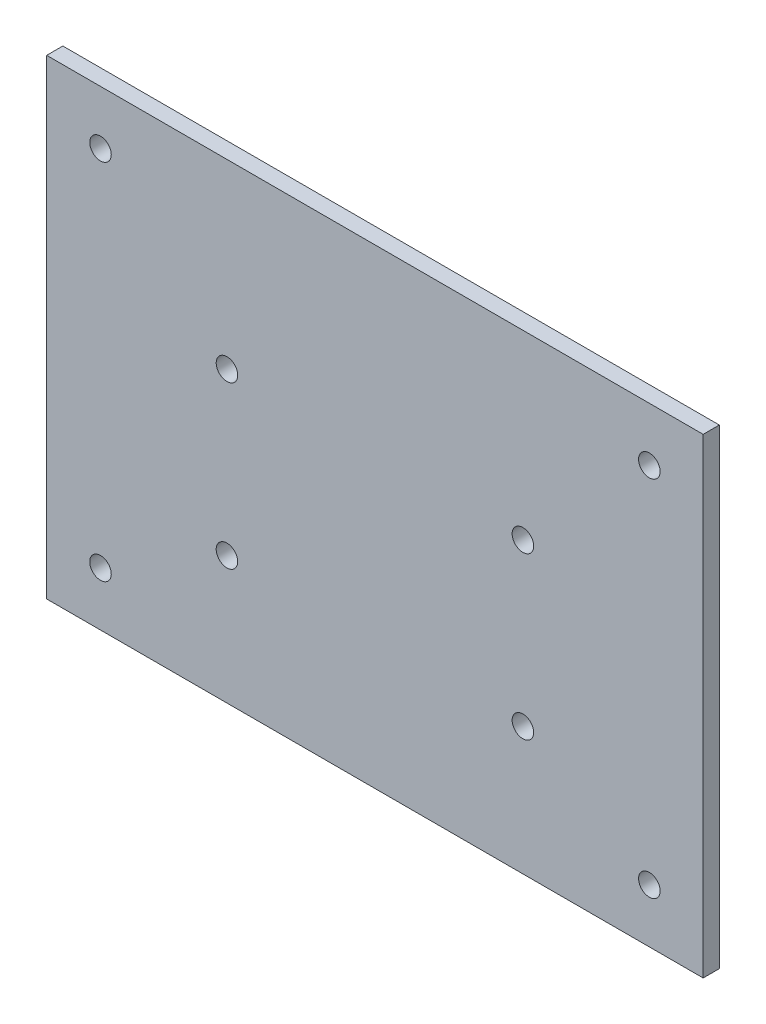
SolidWorks part; units mm, degrees
ref_plane "前视基准面" through (0, 0, 0) normal (0, 0, 1) x (1, 0, 0)
ref_plane "上视基准面" through (0, 0, 0) normal (0, 1, 0) x (1, 0, 0)
ref_plane "右视基准面" through (0, 0, 0) normal (1, 0, 0) x (0, 0, -1)
sketch "草图1" plane through (0, 0, 0) normal (0, 0, 1) x (1, 0, 0)
  line L1 (-61, 43.75) -> (61, 43.75)
  line L2 (-61, 43.75) -> (-61, -43.75)
  line L3 (-61, -43.75) -> (61, -43.75)
  line L4 (61, 43.75) -> (61, -43.75)
  line L5 (-61, 43.75) -> (61, -43.75) construction
  line L6 (-61, -43.75) -> (61, 43.75) construction
  point P0 (0, 0)
  dimension "D1" = 87.5
  dimension "D2" = 122
extrude "凸台-拉伸1" add sketch "草图1" along normal blind 3
hole_wizard "Ø4.0 (4) 直径孔1" positions "草图3" profile "草图4" hole size "Ø4.0" standard "GB"
sketch "草图3" plane through (0, 0, 3) normal (0, 0, 1) x (1, 0, 0)
  point P0 (-27.5, 10)
  point P2 (-27.5, -20)
  point P4 (27.5, 10)
  point P6 (27.5, -20)
  dimension "D1" = 30
  dimension "D2" = 30
  dimension "D3" = 10
  dimension "D4" = 10
  dimension "D5" = 27.5
  dimension "D6" = 27.5
  dimension "D7" = 27.5
  dimension "D8" = 27.5
sketch "草图4" plane through (-27.5, 10, 3) normal (1, 0, 0) x (0, -1, 0)
  line L0 (0, 0) -> (0, 3)
  line L1 (0, 3) -> (2, 3)
  line L2 (2, 3) -> (2, 0)
  line L5 (2, 0) -> (0, 0)
  line L11 (0, -6.35) -> (0, 107.95) construction
  dimension "通孔孔直径" = 4
  dimension "通孔孔深度" = 3
hole_wizard "Ø4.0 (4) 直径孔2" positions "草图5" profile "草图6" hole size "Ø4.0" standard "GB"
sketch "草图5" plane through (0, 0, 3) normal (0, 0, 1) x (1, 0, 0)
  line L0 (61, 43.75) -> (-61, 43.75) construction
  line L1 (-61, 43.75) -> (-61, -43.75) construction
  line L2 (61, -43.75) -> (61, 43.75) construction
  line L3 (-61, -43.75) -> (61, -43.75) construction
  point P0 (-51, 33.75)
  point P2 (-51, -33.75)
  point P4 (51, 33.75)
  point P6 (51, -33.75)
  dimension "D1" = 10
  dimension "D2" = 10
  dimension "D3" = 10
  dimension "D4" = 10
  dimension "D5" = 10
  dimension "D6" = 10
  dimension "D7" = 10
  dimension "D8" = 10
sketch "草图6" plane through (-51, 33.75, 3) normal (1, 0, 0) x (0, -1, 0)
  line L0 (0, 0) -> (0, 3)
  line L1 (0, 3) -> (2, 3)
  line L2 (2, 3) -> (2, 0)
  line L5 (2, 0) -> (0, 0)
  line L11 (0, -6.35) -> (0, 107.95) construction
  dimension "通孔孔直径" = 4
  dimension "通孔孔深度" = 3
sketch "草图7" plane through (0, 0, 3) normal (0, 0, 1) x (1, 0, 0)
  line L0 (-51, 35.75) -> (-51, 31.75) construction
  line L1 (-49, 35.75) -> (-49, 31.75)
  line L2 (-53, 35.75) -> (-53, 31.75)
  line L3 (-51, -31.75) -> (-51, -35.75) construction
  line L4 (-49, -31.75) -> (-49, -35.75)
  line L5 (-53, -31.75) -> (-53, -35.75)
  line L6 (-27.5, 12) -> (-27.5, 8) construction
  line L7 (-25.5, 12) -> (-25.5, 8)
  line L8 (-29.5, 12) -> (-29.5, 8)
  line L9 (-27.5, -18) -> (-27.5, -22) construction
  line L10 (-25.5, -18) -> (-25.5, -22)
  line L11 (-29.5, -18) -> (-29.5, -22)
  line L12 (27.5, 12) -> (27.5, 8) construction
  line L13 (29.5, 12) -> (29.5, 8)
  line L14 (25.5, 12) -> (25.5, 8)
  line L15 (27.5, -18) -> (27.5, -22) construction
  line L16 (29.5, -18) -> (29.5, -22)
  line L17 (25.5, -18) -> (25.5, -22)
  line L18 (51, -31.75) -> (51, -35.75) construction
  line L19 (53, -31.75) -> (53, -35.75)
  line L20 (49, -31.75) -> (49, -35.75)
  line L21 (51, 35.75) -> (51, 31.75) construction
  line L22 (53, 35.75) -> (53, 31.75)
  line L23 (49, 35.75) -> (49, 31.75)
  circle A0 centre (-51, 33.75) radius 2 construction
  arc A1 (-49, 35.75) -> (-53, 35.75) centre (-51, 35.75) ccw
  arc A2 (-53, 31.75) -> (-49, 31.75) centre (-51, 31.75) ccw
  circle A3 centre (-51, -33.75) radius 2 construction
  arc A4 (-49, -31.75) -> (-53, -31.75) centre (-51, -31.75) ccw
  arc A5 (-53, -35.75) -> (-49, -35.75) centre (-51, -35.75) ccw
  circle A6 centre (-27.5, 10) radius 2 construction
  arc A7 (-25.5, 12) -> (-29.5, 12) centre (-27.5, 12) ccw
  arc A8 (-29.5, 8) -> (-25.5, 8) centre (-27.5, 8) ccw
  circle A9 centre (-27.5, -20) radius 2 construction
  arc A10 (-25.5, -18) -> (-29.5, -18) centre (-27.5, -18) ccw
  arc A11 (-29.5, -22) -> (-25.5, -22) centre (-27.5, -22) ccw
  circle A12 centre (27.5, 10) radius 2 construction
  arc A13 (29.5, 12) -> (25.5, 12) centre (27.5, 12) ccw
  arc A14 (25.5, 8) -> (29.5, 8) centre (27.5, 8) ccw
  circle A15 centre (27.5, -20) radius 2 construction
  arc A16 (29.5, -18) -> (25.5, -18) centre (27.5, -18) ccw
  arc A17 (25.5, -22) -> (29.5, -22) centre (27.5, -22) ccw
  circle A18 centre (51, -33.75) radius 2 construction
  arc A19 (53, -31.75) -> (49, -31.75) centre (51, -31.75) ccw
  arc A20 (49, -35.75) -> (53, -35.75) centre (51, -35.75) ccw
  circle A21 centre (51, 33.75) radius 2 construction
  arc A22 (53, 35.75) -> (49, 35.75) centre (51, 35.75) ccw
  arc A23 (49, 31.75) -> (53, 31.75) centre (51, 31.75) ccw
  point P5 (-51, 33.75)
  point P10 (-51, -33.75)
  point P20 (-27.5, 10)
  point P30 (-27.5, -20)
  point P39 (27.5, 10)
  point P49 (27.5, -20)
  point P59 (51, -33.75)
  point P69 (51, 33.75)
  dimension "D1" = 2
  dimension "D2" = 2
  dimension "D3" = 2
  dimension "D4" = 2
  dimension "D5" = 2
  dimension "D6" = 2
  dimension "D7" = 2
  dimension "D8" = 2
extrude "切除-拉伸1" [suppressed] cut sketch "草图7" against normal up to next
